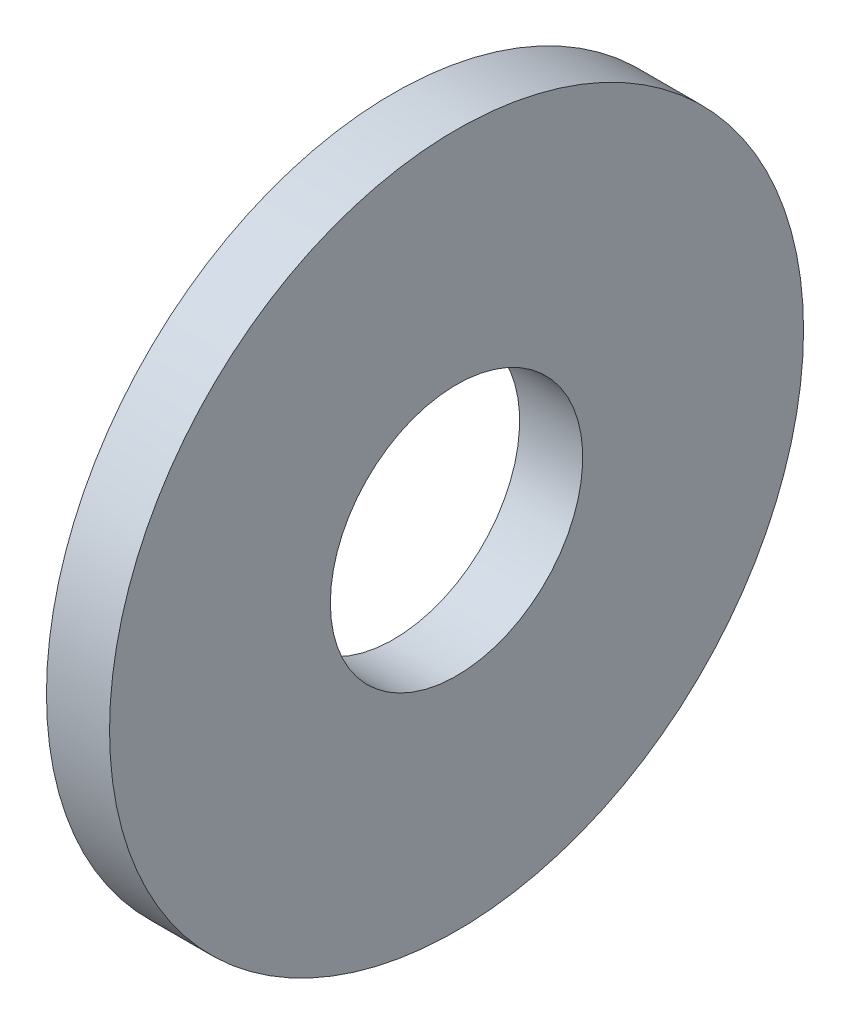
SolidWorks part; units mm, degrees
ref_plane "Plan de face" through (0, 0, 0) normal (0, 0, 1) x (1, 0, 0)
ref_plane "Plan de dessus" through (0, 0, 0) normal (0, 1, 0) x (1, 0, 0)
ref_plane "Plan de droite" through (0, 0, 0) normal (1, 0, 0) x (0, 0, -1)
sketch "Esquisse1" plane through (0, 0, 0) normal (0, 0, 1) x (1, 0, 0)
  line L0 (-20.0871, 0) -> (27.8074, 0) construction
  line L1 (0, 10) -> (0, 27.5)
  line L2 (0, 27.5) -> (-5, 27.5)
  line L3 (-5, 27.5) -> (-5, 22.5)
  line L4 (-5, 22.5) -> (-2, 21.5)
  line L5 (-2, 21.5) -> (-2, 15.5)
  line L6 (-2, 15.5) -> (-5, 14)
  line L7 (-5, 14) -> (-5, 10)
  line L8 (-5, 10) -> (0, 10)
  dimension "D1" = 10
  dimension "D2" = 17.5
  dimension "D3" = 5
  dimension "D4" = 4
  dimension "D5" = 2
  dimension "D6" = 6
  dimension "D7" = 5
  dimension "D8" = 6
  dimension "D9" = 5
revolve "Révolution1" add sketch "Esquisse1" angle 360 about L0
